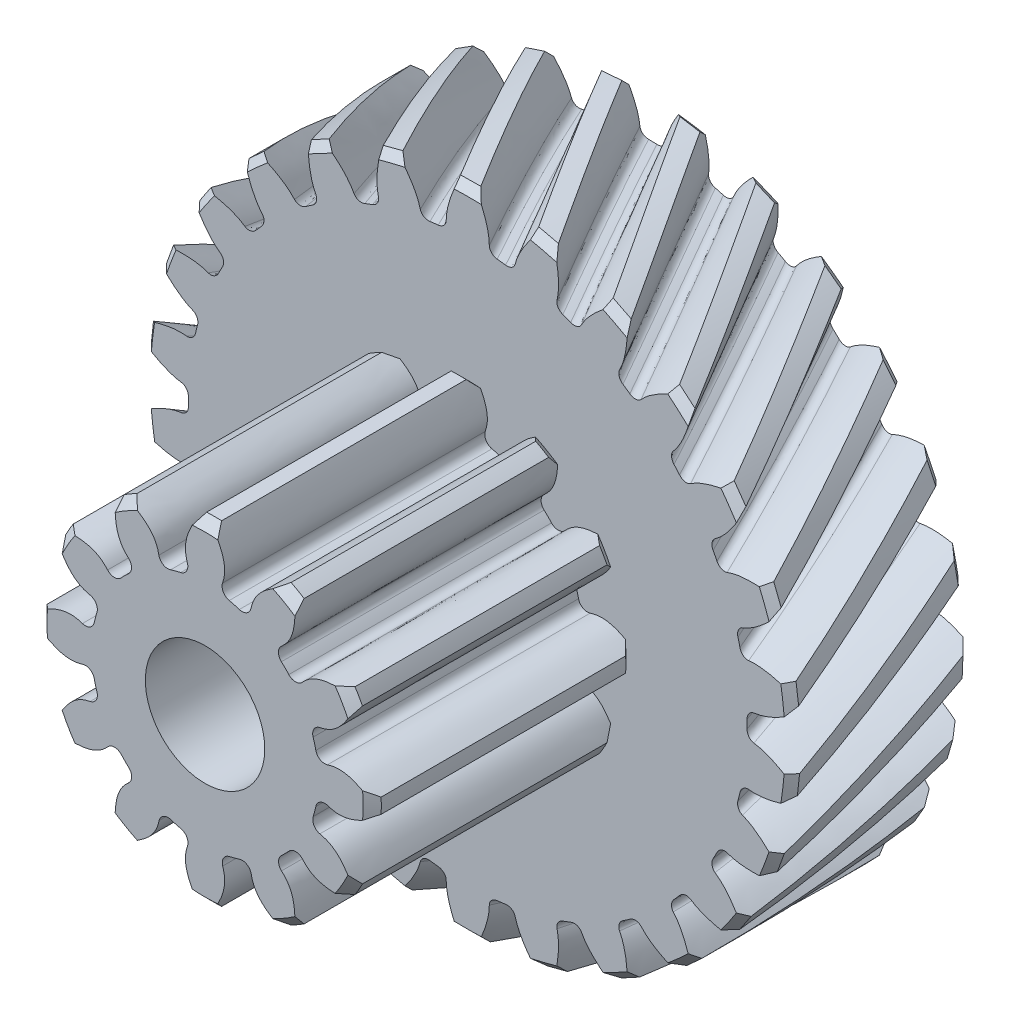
SolidWorks part; units mm, degrees
ref_plane "Plan de face" through (0, 0, 0) normal (0, 0, 1) x (1, 0, 0)
ref_plane "Plan de dessus" through (0, 0, 0) normal (0, 1, 0) x (1, 0, 0)
ref_plane "Plan de droite" through (0, 0, 0) normal (1, 0, 0) x (0, 0, -1)
other "Joindre1"
other "Roue dentée de 26 dents<1>@Dentures hybrides"
other "Roue dentée 12 dents module 1<1>@Dentures hybrides"
sketch "Esquisse1" plane through (0, 0, 5.5) normal (0, 0, 1) x (1, 0, 0)
  circle A0 centre (-1.8584, 2.766) radius 2.5
  dimension "D1" = 5
extrude "Enlèv. mat.-Extru.1" cut sketch "Esquisse1" against normal through all
sketch "Esquisse2" plane through (0, 0, -12.95) normal (0, 0, -1) x (-1, 0, 0)
  line L0 (1.8584, 2.766) -> (1.8584, 18.0315) construction
  line L2 (1.8584, 2.766) -> (10.3145, 17.4123) construction
  line L4 (2.0584, 6.5429) -> (2.0584, 13.8278)
  line L5 (3.5736, 6.1369) -> (7.2161, 12.4458)
  arc A1 (3.1859, 6.0044) -> (2.328, 6.2343) centre (1.8584, 2.766) ccw
  arc A2 (2.0584, 6.5429) -> (2.328, 6.2343) centre (2.3697, 6.5429) ccw
  arc A5 (3.5736, 6.1369) -> (3.1859, 6.0044) centre (3.304, 6.2925) cw
  arc A6 (7.0895, 12.878) -> (7.2161, 12.4458) centre (6.9465, 12.6015) cw
  arc A7 (2.3841, 14.1388) -> (2.0584, 13.8278) centre (2.3697, 13.8278) ccw
  arc A8 (7.0895, 12.878) -> (2.3841, 14.1388) centre (1.8584, 2.766) ccw
  circle A9 centre (1.8584, 2.766) radius 2.5 construction
  point P3 (2.0584, 2.766)
  point P4 (2.0584, 18.0315)
  point P7 (1.6852, 2.866)
  point P14 (10.1413, 17.5123)
  dimension "D2" = 1
  dimension "D3" = 22.77
  dimension "D6" = 0.3113
  dimension "D4" = 30
  dimension "D1" = 0.4
  dimension "D5" = 0.4
extrude "Enlèv. mat.-Extru.2" cut sketch "Esquisse2" against normal blind 6
pattern_circular "Répétition circulaire1" count 12 over 360 about axis through (-1.8584, 2.766, 0) along (0, 0, 1) of "Enlèv. mat.-Extru.2"
sketch "Esquisse3" plane through (0, 0, -12.95) normal (0, 0, -1) x (-1, 0, 0)
  arc A2 (-4.2833, 12.3523) -> (-7.7279, 8.9077) centre (1.8584, 2.766) ccw construction
  arc A3 (1.3888, 6.2343) -> (0.5309, 6.0044) centre (1.8584, 2.766) ccw construction
  circle A4 centre (1.8584, 2.766) radius 11.385
  circle A5 centre (1.8584, 2.766) radius 3.5
extrude "Enlèv. mat.-Extru.3" cut sketch "Esquisse3" against normal blind 0.5
